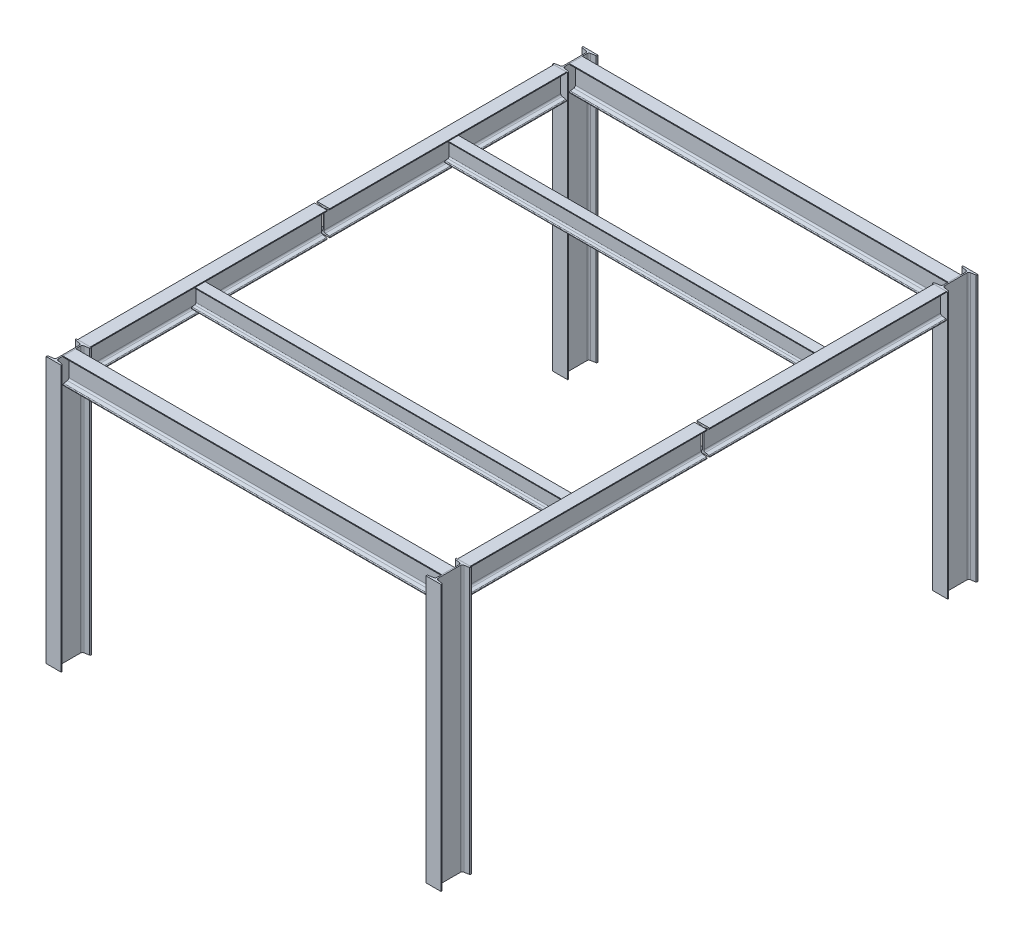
SolidWorks part; units mm, degrees
ref_plane "Front Plane" through (0, 0, 0) normal (0, 0, 1) x (1, 0, 0)
ref_plane "Top Plane" through (0, 0, 0) normal (0, 1, 0) x (1, 0, 0)
ref_plane "Right Plane" through (0, 0, 0) normal (1, 0, 0) x (0, 0, -1)
sketch3d "3DSketch1"
  line L0 (0, 0, 0) -> (0, 1000, 0)
  line L1 (0, 1000, 0) -> (1500, 1000, 0)
  line L2 (1500, 1000, 0) -> (1500, 0, 0)
  line L3 (1500, 0, 0) -> (0, 0, 0)
  line L4 (0, 0, 0) -> (0, 0, 2000) construction
  line L5 (0, 0, 2000) -> (1500, 0, 2000)
  line L6 (1500, 0, 2000) -> (1500, 1000, 2000)
  line L7 (1500, 1000, 2000) -> (0, 1000, 2000)
  line L8 (0, 1000, 2000) -> (0, 0, 2000)
  line L9 (0, 1000, 2000) -> (0, 1000, 1500) construction
  line L10 (1500, 1000, 0) -> (1500, 1000, 1500) construction
  line L11 (1500, 0, 2000) -> (1500, 0, 0) construction
  line L12 (1500, 1000, 1500) -> (1500, 1000, 2000) construction
  line L13 (0, 1000, 1500) -> (0, 1000, 0) construction
  line L14 (0, 1000, 1500) -> (1500, 1000, 1500)
  line L15 (0, 1000, 500) -> (1500, 1000, 500)
  line L16 (0, 1000, 2000) -> (0, 1000, 1000) construction
  line L17 (1500, 1000, 2000) -> (1500, 1000, 1000) construction
  line L18 (0, 1000, 0) -> (0, 1000, 1000) construction
  line L19 (1500, 1000, 0) -> (1500, 1000, 1000) construction
  line L20 (1500, 1000, 0) -> (1500, 1000, 995)
  line L21 (0, 1000, 0) -> (0, 1000, 995)
  line L22 (1500, 1000, 2000) -> (1500, 1000, 1005)
  line L23 (0, 1000, 2000) -> (0, 1000, 1005)
  point P9 (1500, 1000, 1500)
  point P10 (0, 1000, 1500)
  dimension "D1" = 1000
  dimension "D2" = 1500
  dimension "D3" = 2000
  dimension "D4" = 500
  dimension "D5" = 500
  dimension "D6" = 1000
  dimension "D7" = 995
ref_plane "Plane3" through (0, 1000, 0) normal (0, -1, 0) x (-1, 0, 0)
other "Structure System1"
sketch3d "Structure System Grid1"
  line L0 (0, 1050, 2000) -> (0, 0, 2000)
  line L1 (0, 0, 0) -> (0, 1050, 0)
  line L2 (1500, 1050, 0) -> (1500, 0, 0)
  line L3 (1500, 0, 2000) -> (1500, 1050, 2000)
  line L4 (0, 1000, 2000) -> (1500, 1000, 2000)
  line L5 (0, 1000, 0) -> (1500, 1000, 0)
  line L6 (1500, 1000, 500) -> (0, 1000, 500)
  line L7 (1500, 1000, 1500) -> (0, 1000, 1500)
  line L8 (1500, 1000, 0) -> (1500, 1000, 995)
  line L9 (1500, 1000, 2000) -> (1500, 1000, 1005)
  line L10 (0, 1000, 0) -> (0, 1000, 995)
  line L11 (0, 1000, 2000) -> (0, 1000, 1005)
other "<ISO><sb beam><120 X 12>(1)"
ref_plane "Plane2" through (0, 1000, 2000) normal (0, -1, 0) x (1, 0, 0)
sketch "Sketch11" plane through (0, 1000, 2000) normal (0, -1, 0) x (1, 0, 0)
  line L0 (-30, -60) -> (-30, -57.3814)
  line L1 (-27.347, -54.2496) -> (-9.1847, -51.2224)
  line L2 (-2.5, -43.3312) -> (-2.5, 43.3312)
  line L3 (-9.1847, 51.2224) -> (-27.347, 54.2496)
  line L4 (-30, 57.3814) -> (-30, 60)
  line L5 (-30, 60) -> (30, 60)
  line L6 (30, 60) -> (30, 57.3814)
  line L7 (27.347, 54.2496) -> (9.1847, 51.2224)
  line L8 (2.5, 43.3312) -> (2.5, -43.3312)
  line L9 (9.1847, -51.2224) -> (27.347, -54.2496)
  line L10 (30, -57.3814) -> (30, -60)
  line L11 (30, -60) -> (-30, -60)
  line L14 (6.0938, -52.4) -> (-4.15, -52.4) construction
  line L15 (-2.5, 0) -> (2.5, 0) construction
  arc A0 (-9.1847, -51.2224) -> (-2.5, -43.3312) centre (-10.5, -43.3312) ccw
  arc A1 (-2.5, 43.3312) -> (-9.1847, 51.2224) centre (-10.5, 43.3312) ccw
  arc A2 (9.1847, 51.2224) -> (2.5, 43.3312) centre (10.5, 43.3312) ccw
  arc A3 (2.5, -43.3312) -> (9.1847, -51.2224) centre (10.5, -43.3312) ccw
  arc A4 (30, -57.3814) -> (27.347, -54.2496) centre (26.825, -57.3814) ccw
  arc A5 (-30, -57.3814) -> (-27.347, -54.2496) centre (-26.825, -57.3814) cw
  arc A6 (-27.347, 54.2496) -> (-30, 57.3814) centre (-26.825, 57.3814) cw
  arc A7 (27.347, 54.2496) -> (30, 57.3814) centre (26.825, 57.3814) ccw
  point P21 (0, 60)
  point P23 (0, -60)
  point P35 (0, 0)
  dimension "D7" = 9.463
  dimension "RI" = 8
  dimension "D2" = 3.175
  dimension "BF" = 60
  dimension "D6" = 9.463
  dimension "DEPTH" = 120
  dimension "TW" = 5
  dimension "D1" = 86.6625
  dimension "TF" = 7.6
other "Member1"
other "Member2"
other "Member3"
other "Member4"
ref_plane "Horizontal Plane(Member4)" through (1470, 0, 2000) normal (0, 0, -1) x (0, 1, 0)
other "<ISO><sb beam><100 X 8>(1)"
ref_plane "Plane5" through (0, 1000, 2000) normal (1, 0, 0) x (0, 0, 1)
sketch "Sketch12" plane through (0, 1000, 2000) normal (1, 0, 0) x (0, 0, 1)
  line L0 (-25, -50) -> (-25, -47.7854)
  line L1 (-22.347, -44.6536) -> (-8.0991, -42.2787)
  line L2 (-2.25, -35.374) -> (-2.25, 35.374)
  line L3 (-8.0991, 42.2787) -> (-22.347, 44.6536)
  line L4 (-25, 47.7854) -> (-25, 50)
  line L5 (-25, 50) -> (25, 50)
  line L6 (25, 50) -> (25, 47.7854)
  line L7 (22.347, 44.6536) -> (8.0991, 42.2787)
  line L8 (2.25, 35.374) -> (2.25, -35.374)
  line L9 (8.0991, -42.2787) -> (22.347, -44.6536)
  line L10 (25, -47.7854) -> (25, -50)
  line L11 (25, -50) -> (-25, -50)
  line L14 (4.8438, -43.2) -> (-5.4, -43.2) construction
  line L15 (-2.25, 0) -> (2.25, 0) construction
  arc A0 (-8.0991, -42.2787) -> (-2.25, -35.374) centre (-9.25, -35.374) ccw
  arc A1 (-2.25, 35.374) -> (-8.0991, 42.2787) centre (-9.25, 35.374) ccw
  arc A2 (8.0991, 42.2787) -> (2.25, 35.374) centre (9.25, 35.374) ccw
  arc A3 (2.25, -35.374) -> (8.0991, -42.2787) centre (9.25, -35.374) ccw
  arc A4 (25, -47.7854) -> (22.347, -44.6536) centre (21.825, -47.7854) ccw
  arc A5 (-25, -47.7854) -> (-22.347, -44.6536) centre (-21.825, -47.7854) cw
  arc A6 (-22.347, 44.6536) -> (-25, 47.7854) centre (-21.825, 47.7854) cw
  arc A7 (22.347, 44.6536) -> (25, 47.7854) centre (21.825, 47.7854) ccw
  point P21 (0, 50)
  point P23 (0, -50)
  point P35 (0, 0)
  dimension "D7" = 9.463
  dimension "RI" = 7
  dimension "D2" = 3.175
  dimension "BF" = 50
  dimension "D6" = 9.463
  dimension "DEPTH" = 100
  dimension "TW" = 4.5
  dimension "D1" = 70.748
  dimension "TF" = 6.8
other "Member5"
other "Member6"
other "Member17"
ref_plane "Horizontal Plane(Member17)" through (1525, 1000, 0) normal (0, -1, 0) x (0, 0, 1)
other "Member18"
ref_plane "Horizontal Plane(Member18)" through (1525, 1000, 2000) normal (0, 1, 0) x (0, 0, -1)
other "Member19"
ref_plane "Horizontal Plane(Member19)" through (-25, 1000, 0) normal (0, 1, 0) x (0, 0, 1)
other "Member20"
ref_plane "End Plane 2(Member20)" through (-25, 1050, 1005) normal (0, 0, -1) x (1, 0, 0)
ref_plane "Horizontal Plane(Member20)" through (-25, 1000, 2000) normal (0, -1, 0) x (0, 0, -1)
other "<ISO><sb beam><80 X 6>(1)"
ref_plane "Plane9" through (1500, 1000, 500) normal (-1, 0, 0) x (0, 0, -1)
sketch "Sketch1" plane through (1500, 1000, 500) normal (-1, 0, 0) x (0, 0, -1)
  line L0 (-20, -40) -> (-20, -38.1895)
  line L1 (-17.347, -35.0577) -> (-7.0135, -33.3354)
  line L2 (-2, -27.417) -> (-2, 27.417)
  line L3 (-7.0135, 33.3354) -> (-17.347, 35.0577)
  line L4 (-20, 38.1895) -> (-20, 40)
  line L5 (-20, 40) -> (20, 40)
  line L6 (20, 40) -> (20, 38.1895)
  line L7 (17.347, 35.0577) -> (7.0135, 33.3354)
  line L8 (2, 27.417) -> (2, -27.417)
  line L9 (7.0135, -33.3354) -> (17.347, -35.0577)
  line L10 (20, -38.1895) -> (20, -40)
  line L11 (20, -40) -> (-20, -40)
  line L14 (3.5938, -34) -> (-6.65, -34) construction
  line L15 (-2, 0) -> (2, 0) construction
  arc A0 (-7.0135, -33.3354) -> (-2, -27.417) centre (-8, -27.417) ccw
  arc A1 (-2, 27.417) -> (-7.0135, 33.3354) centre (-8, 27.417) ccw
  arc A2 (7.0135, 33.3354) -> (2, 27.417) centre (8, 27.417) ccw
  arc A3 (2, -27.417) -> (7.0135, -33.3354) centre (8, -27.417) ccw
  arc A4 (20, -38.1895) -> (17.347, -35.0577) centre (16.825, -38.1895) ccw
  arc A5 (-20, -38.1895) -> (-17.347, -35.0577) centre (-16.825, -38.1895) cw
  arc A6 (-17.347, 35.0577) -> (-20, 38.1895) centre (-16.825, 38.1895) cw
  arc A7 (17.347, 35.0577) -> (20, 38.1895) centre (16.825, 38.1895) ccw
  point P21 (0, 40)
  point P23 (0, -40)
  point P35 (0, 0)
  dimension "D7" = 9.463
  dimension "RI" = 6
  dimension "D2" = 3.175
  dimension "BF" = 40
  dimension "D6" = 9.463
  dimension "DEPTH" = 80
  dimension "TW" = 4
  dimension "D1" = 54.834
  dimension "TF" = 6
other "Member21"
ref_plane "Horizontal Plane(Member21)" through (1500, 1000, 520) normal (0, -1, 0) x (-1, 0, 0)
other "Member22"
ref_plane "Horizontal Plane(Member22)" through (1500, 1000, 1480) normal (0, 1, 0) x (-1, 0, 0)
other "Corner Management1"
other "Complex Corner Group3"
other "Corner1"
other "Corner2"
other "Corner3"
other "Corner4"
other "Simple Corner Group3"
other "Corner7"
other "Corner8"
other "Corner9"
other "Corner10"
ref_plane "Front Plane-L Clip" through (1492.75, 1000, 1493) normal (0, 1, 0) x (0, 0, -1)
ref_plane "Top Plane-L Clip" through (1492.75, 1000, 1493) normal (-1, 0, 0) x (0, 0, -1)
ref_plane "Right Plane-L Clip" through (1492.75, 1000, 1493) normal (0, 0, -1) x (0, -1, 0)
ref_plane "Front Plane-StockInstance1" through (7.25, 1000, 1493) normal (0, 1, 0) x (-1, 0, 0)
ref_plane "Front Plane-StockInstance1" through (7.25, 1000, 493) normal (0, 1, 0) x (-1, 0, 0)
ref_plane "Front Plane-StockInstance2" through (7.25, 1000, 1493) normal (0, 1, 0) x (-1, 0, 0)
ref_plane "Front Plane-StockInstance3" through (1492.75, 1000, 493) normal (0, 1, 0) x (1, 0, 0)
